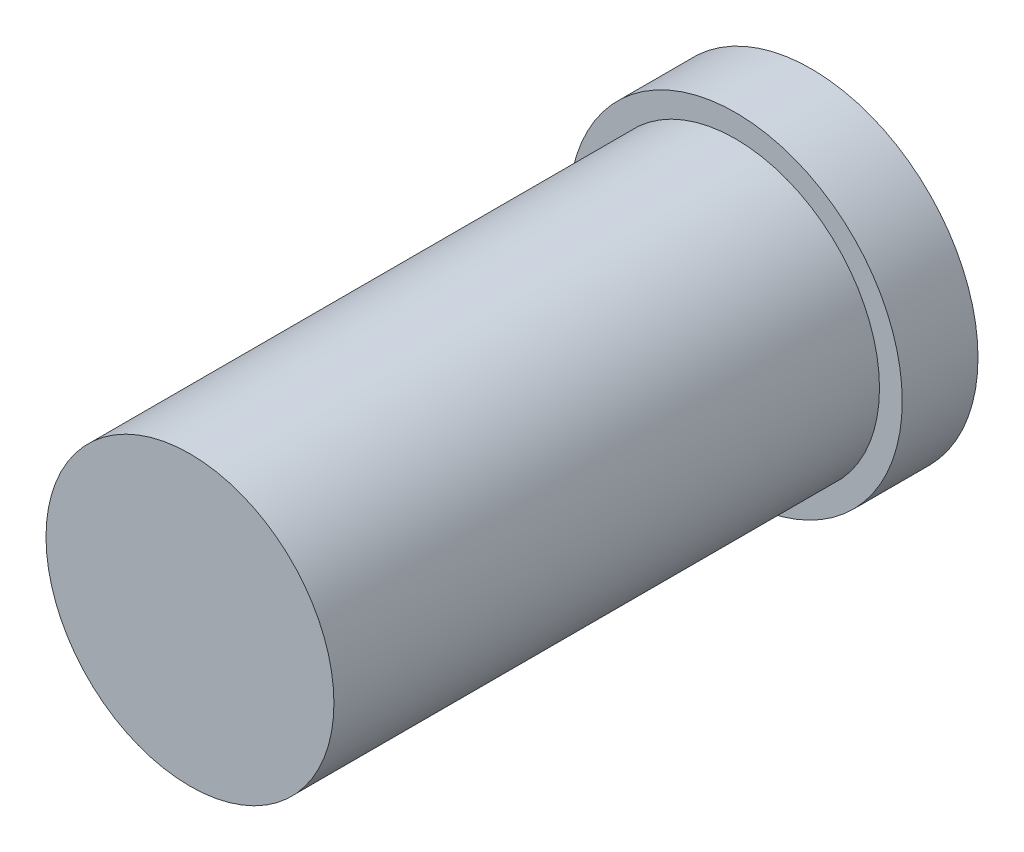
SolidWorks part; units mm, degrees
ref_plane "Front Plane" through (0, 0, 0) normal (0, 0, 1) x (1, 0, 0)
ref_plane "Top Plane" through (0, 0, 0) normal (0, 1, 0) x (1, 0, 0)
ref_plane "Right Plane" through (0, 0, 0) normal (1, 0, 0) x (0, 0, -1)
sketch "Sketch1" plane through (0, 0, 0) normal (0, 0, 1) x (1, 0, 0)
  circle A0 centre (0, 0) radius 11
  dimension "D1" = 22
extrude "Boss-Extrude1" add sketch "Sketch1" along normal blind 5
sketch "Sketch3" plane through (0, 0, 5) normal (0, 0, 1) x (1, 0, 0)
  circle A0 centre (0, 0) radius 9.5
  dimension "D1" = 19
extrude "Boss-Extrude2" add sketch "Sketch3" along normal blind 36
